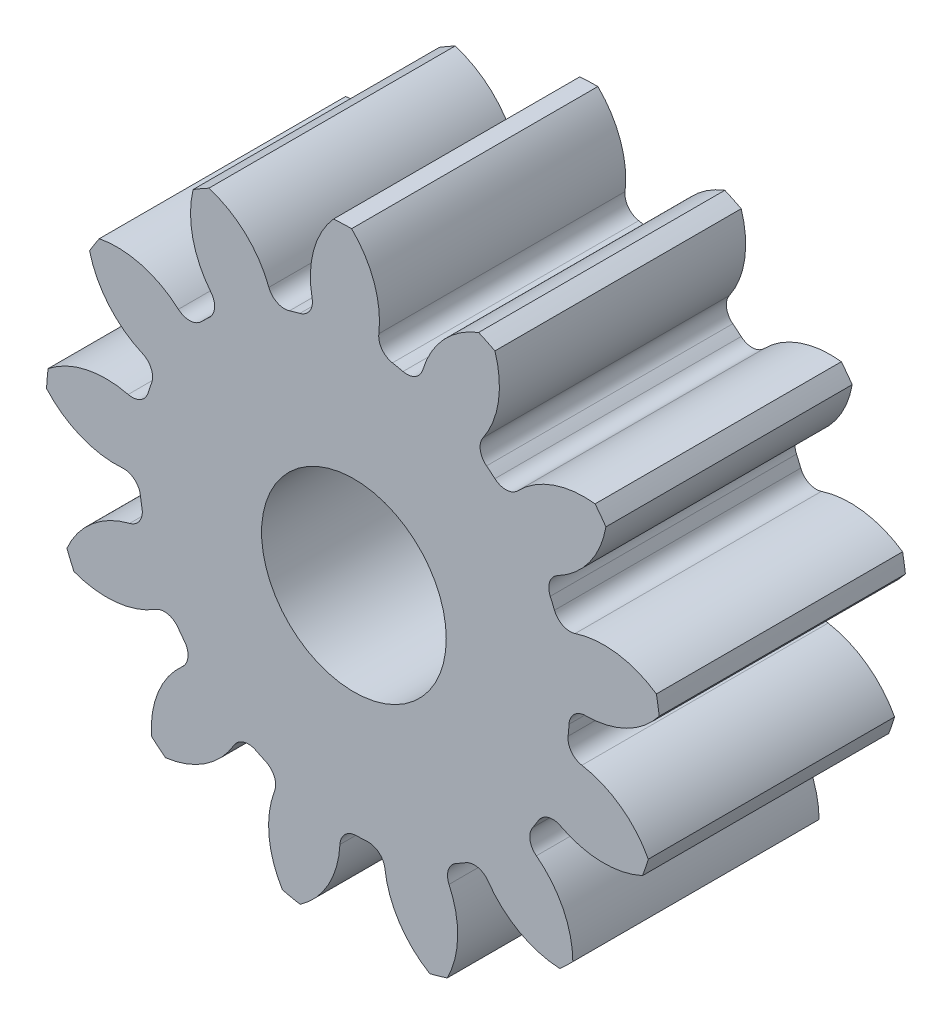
SolidWorks part; units mm, degrees
ref_plane "Front" through (0, 0, 0) normal (0, 0, 1) x (1, 0, 0)
ref_plane "Top" through (0, 0, 0) normal (0, 1, 0) x (1, 0, 0)
ref_plane "Right" through (0, 0, 0) normal (1, 0, 0) x (0, 0, -1)
sketch "Sketch3" plane through (0, 0, 0) normal (0, 0, 1) x (1, 0, 0)
  circle A0 centre (0, 0) radius 127
  dimension "od" = 254
extrude "gearBody" add sketch "Sketch3" along normal blind 101.6
sketch "Sketch2" plane through (0, 0, 0) normal (0, 0, 1) x (1, 0, 0)
  line L0 (0, 0) -> (95.5558, 39.5805) construction
  line L1 (122.2575, -38.6564) -> (0, 0) construction
  line L2 (0, 0) -> (36.3143, 0) construction
  line L3 (109.9911, 4.0777) -> (107.7608, -22.4118) construction
  line L5 (108.8759, -9.1671) -> (0, 0) construction
  line L7 (0, 0) -> (103.4288, 0) construction
  arc A0 (103.4082, 2.0683) -> (101.6065, -19.33) centre (0, 0) ccw construction
  arc A1 (125.9569, 16.2439) -> (121.4675, -37.0763) centre (0, 0) ccw construction
  arc A2 (109.9911, 4.0777) -> (107.7608, -22.4118) centre (0, 0) ccw construction
  arc A3 (88.3712, -9.6817) -> (88.746, -5.231) centre (0, 0) ccw
  arc A4 (122.2575, -38.6564) -> (94.0592, -17.2254) centre (87.5923, -55.0011) ccw
  arc A5 (122.2575, -38.6564) -> (127, 17.6696) centre (0, 0) ccw
  arc A6 (127, 17.6696) -> (95.6152, 1.2553) centre (95.5558, 39.5805) cw
  arc A7 (88.746, -5.231) -> (95.6152, 1.2553) centre (95.6259, -5.6366) cw
  arc A8 (94.0592, -17.2254) -> (88.3712, -9.6817) centre (95.2221, -10.4323) cw
  point P6 (127, 17.6696)
  point P22 (122.2575, -38.6564)
  dimension "baseDia" = 206.8577
  dimension "od" = 254
  dimension "pd" = 220.1333
  dimension "rd" = 177.8
  dimension "rFillet" = 6.8919
  dimension "pointX" = 127
  dimension "pointY" = 17.6696
  dimension "CTT" = 26.4896
  dimension "flankCenterAngle" = 22.5
extrude "toothCut" cut sketch "Sketch2" along normal through all
pattern_circular "CirPattern1" count 13 over 360 about axis through (0, 0, 0) along (0, 0, 1) of "toothCut"
sketch "hub1Dia" plane through (0, 0, 0) normal (0, 0, -1) x (-1, 0, 0)
  circle A0 centre (0, 0) radius 12.7
  dimension "hub1Dia" = 25.4
sketch "hub2Dia" plane through (0, 0, 101.6) normal (0, 0, 1) x (1, 0, 0)
  circle A0 centre (0, 0) radius 12.7
  dimension "hub2dia" = 25.4
sketch "boreDia" plane through (0, 0, 0) normal (0, 0, 1) x (1, 0, 0)
  circle A0 centre (0, 0) radius 38.1
  dimension "boreDia" = 76.2
extrude "bore" cut sketch "boreDia" against normal mid plane 25400
